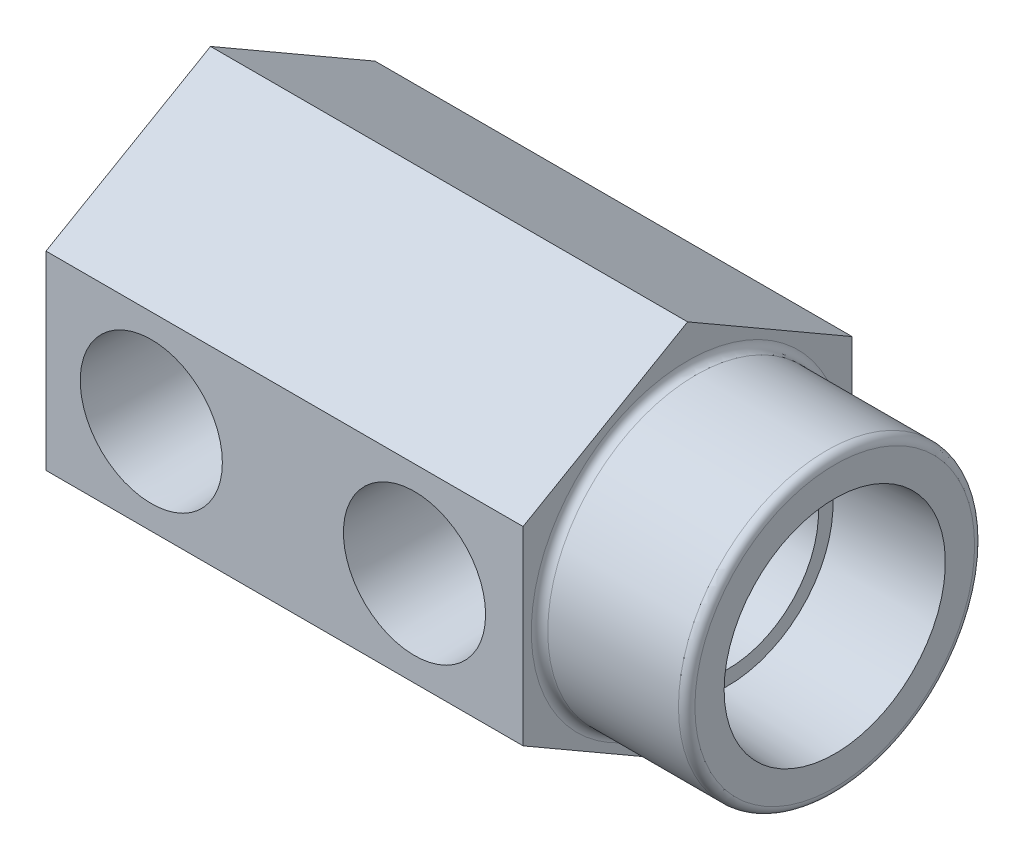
SolidWorks part; units mm, degrees
ref_plane "Front Plane" through (0, 0, 0) normal (0, 0, 1) x (1, 0, 0)
ref_plane "Top Plane" through (0, 0, 0) normal (0, 1, 0) x (1, 0, 0)
ref_plane "Right Plane" through (0, 0, 0) normal (1, 0, 0) x (0, 0, -1)
sketch "Sketch2" plane through (0, 0, 0) normal (1, 0, 0) x (0, 0, -1)
  line L1 (15.875, -9.1654) -> (15.875, 9.1654)
  line L2 (15.875, 9.1654) -> (0, 18.3309)
  line L3 (0, 18.3309) -> (-15.875, 9.1654)
  line L4 (-15.875, 9.1654) -> (-15.875, -9.1654)
  line L5 (-15.875, -9.1654) -> (0, -18.3309)
  line L6 (0, -18.3309) -> (15.875, -9.1654)
  line L7 (0, 20.164) -> (0, -20.164) construction
  circle A0 centre (0, 0) radius 15.875 construction
  dimension "D1" = 31.75
extrude "Boss-Extrude1" add sketch "Sketch2" along normal blind 46.0375 separate body
sketch "Sketch3" plane through (46.0375, 0, 0) normal (1, 0, 0) x (0, 0, -1)
  circle A1 centre (0, 0) radius 14.2875
  dimension "D1" = 28.575
extrude "Boss-Extrude2" add sketch "Sketch3" along normal blind 14.1986
sketch "Sketch5" plane through (0, 0, 0) normal (0, 1, 0) x (1, 0, 0)
  line L0 (-14.0019, 0) -> (49985.9981, 0) construction
  line L12 (49.9364, 8.7312) -> (36.1061, 8.7312)
  line L13 (49.9364, 8.7312) -> (49.9364, 10.1346)
  line L14 (60.2361, 10.6744) -> (49.9364, 10.1346)
  line L15 (60.2361, -14.2875) -> (60.2361, 14.2875) construction
  line L16 (60.2361, 0) -> (60.2361, 10.6744)
  line L18 (36.1061, 0) -> (36.1061, 8.7312)
  line L19 (36.1061, 0) -> (60.2361, 0)
  dimension "D1" = 10.2997
  dimension "D2" = 24.13
  dimension "D5" = 3
  dimension "D8" = 17.4625
  dimension "D11" = 20.2692
revolve "Cut-Revolve1" cut sketch "Sketch5" angle 360 about L0
hole_wizard "1/4 NPT Tapped Hole1" positions "Sketch7" profile "Sketch6" size "1/4" standard "Ansi Inch"
sketch "Sketch7" plane through (0, 0, -15.875) normal (0, 0, -1) x (-1, 0, 0)
  line L0 (17.4625, 0) -> (-17.4625, 0) construction
  line L1 (0, 17.4625) -> (0, -17.4625) construction
  point P0 (-10.16, 0)
  dimension "D1" = 10.16
sketch "Sketch6" plane through (10.16, 0, -15.875) normal (1, 0, 0) x (0, 1, 0)
  line L0 (0, 0) -> (0, 23.5861)
  line L1 (5.5626, 20.2438) -> (0, 23.5861)
  line L2 (-5.5626, 20.2438) -> (0, 23.5861) construction
  line L3 (5.5626, 20.2438) -> (5.5626, 10.0203)
  line L4 (5.5626, 10.0203) -> (6.558, 10.0203)
  line L5 (6.558, 10.0203) -> (6.858, 0)
  line L6 (-6.558, 10.0203) -> (-6.858, 0) construction
  line L7 (6.858, 0) -> (0, 0)
  line L8 (0, -6.35) -> (0, 107.95) construction
  line L11 (-5.5626, 10.0203) -> (-6.558, 10.0203) construction
  dimension "Tap Drill Dia." = 11.1252
  dimension "Tap Drill Depth" = 20.2438
  dimension "Thread Dia." = 13.716
  dimension "Thread Angle" = 3.43
  dimension "Thread Depth" = 10.0203
  dimension "Drill Angle" = 118
hole_wizard "1/4 NPT Tapped Hole2" positions "Sketch9" profile "Sketch8" size "1/4" standard "Ansi Inch"
sketch "Sketch9" plane through (0, 0, 15.875) normal (0, 0, 1) x (1, 0, 0)
  line L0 (0, -17.4625) -> (0, 17.4625) construction
  circle A0 centre (10.16, 0) radius 6.858 construction
  point P0 (10.16, 0)
  point P5 (35.56, 0)
  dimension "D1" = 35.56
sketch "Sketch8" plane through (10.16, 0, 15.875) normal (1, 0, 0) x (0, -1, 0)
  line L0 (0, 0) -> (0, 16.0423)
  line L1 (5.5626, 12.7) -> (0, 16.0423)
  line L2 (-5.5626, 12.7) -> (0, 16.0423) construction
  line L3 (5.5626, 12.7) -> (5.5626, 10.0203)
  line L4 (5.5626, 10.0203) -> (6.558, 10.0203)
  line L5 (6.558, 10.0203) -> (6.858, 0)
  line L6 (-6.558, 10.0203) -> (-6.858, 0) construction
  line L7 (6.858, 0) -> (0, 0)
  line L8 (0, -6.35) -> (0, 107.95) construction
  line L11 (-5.5626, 10.0203) -> (-6.558, 10.0203) construction
  dimension "Tap Drill Dia." = 11.1252
  dimension "Tap Drill Depth" = 12.7
  dimension "Thread Dia." = 13.716
  dimension "Thread Angle" = 3.43
  dimension "Thread Depth" = 10.0203
  dimension "Drill Angle" = 118
fillet "Fillet1" radius 0.7937 2 edges at (60.2361, 0, -14.2875) (46.0375, 0, -14.2875)
hole_wizard "25/64 (0.39063) Diameter Hole1" positions "Sketch13" profile "Sketch12" hole size "25/64" standard "Ansi Inch"
sketch "Sketch13" plane through (60.2361, 0, 0) normal (1, 0, 0) x (0, 0, -1)
  circle A0 centre (0, 0) radius 10.6744 construction
  point P0 (0, 0)
sketch "Sketch12" plane through (60.2361, 0, 0) normal (0, 1, 0) x (0, 0, -1)
  line L0 (0, 0) -> (0, 53.7809)
  line L1 (0, 53.7809) -> (4.961, 50.8)
  line L2 (4.961, 50.8) -> (4.961, 0)
  line L5 (4.961, 0) -> (0, 0)
  line L10 (0, 53.7809) -> (-4.961, 50.8) construction
  line L11 (0, -6.35) -> (0, 107.95) construction
  dimension "Hole Dia." = 9.922
  dimension "Hole Depth" = 50.8
  dimension "Drill Angle" = 118
hole_wizard "1/2-20 Tapped Hole1" positions "Sketch11" profile "Sketch10" tap size "1/2-20" standard "ANSI Inch"
sketch "Sketch11" plane through (60.2361, 0, 0) normal (1, 0, 0) x (0, 0, -1)
  circle A0 centre (0, 0) radius 10.6744 construction
  point P0 (0, 0)
sketch "Sketch10" plane through (60.2361, 0, 0) normal (0, 1, 0) x (0, 0, -1)
  line L0 (0, 0) -> (0, 51.1216)
  line L1 (0, 51.1216) -> (4.7625, 48.26)
  line L2 (4.7625, 48.26) -> (4.7625, 44.45)
  line L3 (4.7625, 44.45) -> (6.35, 44.45)
  line L4 (6.35, 44.45) -> (6.35, 0)
  line L5 (6.35, 0) -> (0, 0)
  line L10 (0, 51.1216) -> (-4.7625, 48.26) construction
  line L11 (0, -6.35) -> (0, 107.95) construction
  dimension "Tap Drill Dia." = 9.525
  dimension "Tap Drill Depth" = 48.26
  dimension "Thread Major Dia." = 12.7
  dimension "Thread Depth" = 44.45
  dimension "Drill Angle" = 118
